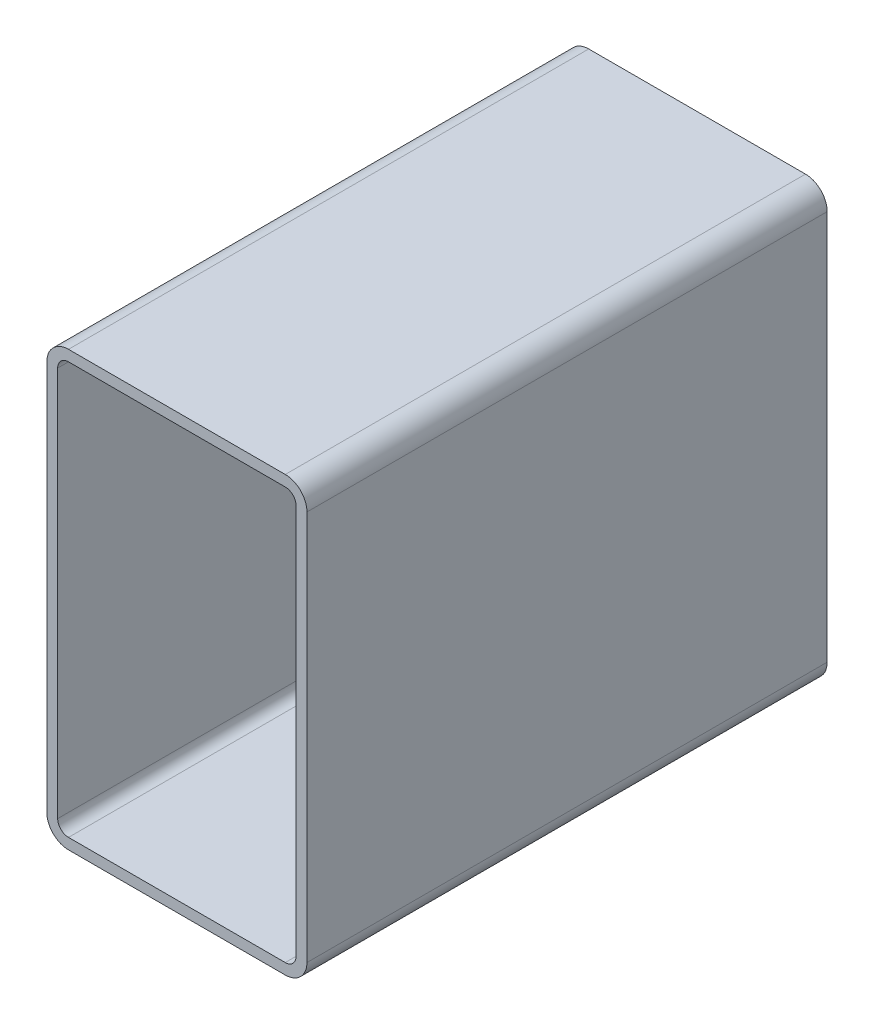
SolidWorks part; units mm, degrees
ref_plane "Front Plane" through (0, 0, 0) normal (0, 0, 1) x (1, 0, 0)
ref_plane "Top Plane" through (0, 0, 0) normal (0, 1, 0) x (1, 0, 0)
ref_plane "Right Plane" through (0, 0, 0) normal (1, 0, 0) x (0, 0, -1)
sketch "Sketch1" plane through (0, 0, 0) normal (0, 0, 1) x (1, 0, 0)
sketch_block_instance "HSS10x6x0.250-1"
sketch_block "HSS10x6x0.250"
extrude "Boss-Extrude1" add sketch "Sketch1" along normal blind 304.8
